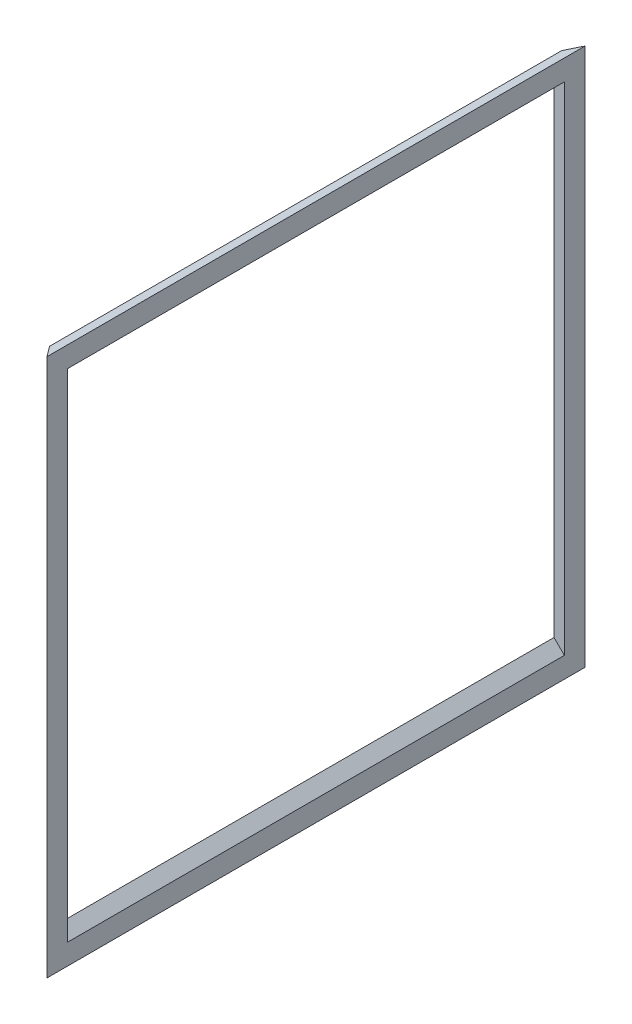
SolidWorks part; units mm, degrees
ref_plane "Front Plane" through (0, 0, 0) normal (1, 0, 0) x (0, 1, 0)
ref_plane "Top Plane" through (0, 0, 0) normal (0, 0, 1) x (0, 1, 0)
ref_plane "Right Plane" through (0, 0, 0) normal (0, 1, 0) x (-1, 0, 0)
sketch "Sketch1" plane through (0, 0, 0) normal (1, 0, 0) x (0, 1, 0)
  line L0 (-75.3872, 76.2) -> (81.7372, 76.2)
  line L1 (81.7372, 76.2) -> (81.7372, 78.5622)
  line L2 (81.7372, 78.5622) -> (-75.3872, 78.5622)
  line L3 (-75.3872, 78.5622) -> (-75.3872, 76.2)
ref_plane "Plane1" through (3.175, 0, 0) normal (1, 0, 0) x (0, 1, 0)
sketch "Sketch2" plane through (3.175, 0, 0) normal (1, 0, 0) x (0, 1, 0)
  line L0 (-82.55, 76.2) -> (82.55, 76.2)
  line L1 (82.55, 76.2) -> (82.55, 82.55)
  line L2 (82.55, 82.55) -> (-82.55, 82.55)
  line L3 (-82.55, 82.55) -> (-82.55, 76.2)
loft "Gap_bridge_0" add profiles "Sketch1", "Sketch2"
sketch "Sketch3" plane through (0, 0, 0) normal (1, 0, 0) x (0, 1, 0)
  line L0 (-75.3872, -78.5622) -> (81.7372, -78.5622)
  line L1 (81.7372, -78.5622) -> (81.7372, -76.2)
  line L2 (81.7372, -76.2) -> (-75.3872, -76.2)
  line L3 (-75.3872, -76.2) -> (-75.3872, -78.5622)
ref_plane "Plane2" through (3.175, 0, 0) normal (1, 0, 0) x (0, 1, 0)
sketch "Sketch4" plane through (3.175, 0, 0) normal (1, 0, 0) x (0, 1, 0)
  line L0 (-82.55, -82.55) -> (82.55, -82.55)
  line L1 (82.55, -82.55) -> (82.55, -76.2)
  line L2 (82.55, -76.2) -> (-82.55, -76.2)
  line L3 (-82.55, -76.2) -> (-82.55, -82.55)
loft "Gap_bridge_1" add profiles "Sketch3", "Sketch4"
sketch "Sketch5" plane through (0, 0, 0) normal (1, 0, 0) x (0, 1, 0)
  line L0 (79.375, -76.2) -> (81.7372, -76.2)
  line L1 (81.7372, -76.2) -> (81.7372, 76.2)
  line L2 (81.7372, 76.2) -> (79.375, 76.2)
  line L3 (79.375, 76.2) -> (79.375, -76.2)
ref_plane "Plane3" through (3.175, 0, 0) normal (1, 0, 0) x (0, 1, 0)
sketch "Sketch6" plane through (3.175, 0, 0) normal (1, 0, 0) x (0, 1, 0)
  line L0 (76.2, -76.2) -> (82.55, -76.2)
  line L1 (82.55, -76.2) -> (82.55, 76.2)
  line L2 (82.55, 76.2) -> (76.2, 76.2)
  line L3 (76.2, 76.2) -> (76.2, -76.2)
loft "Gap_bridge_2" add profiles "Sketch5", "Sketch6"
sketch "Sketch7" plane through (0, 0, 0) normal (1, 0, 0) x (0, 1, 0)
  line L0 (-75.3872, -76.2) -> (-73.025, -76.2)
  line L1 (-73.025, -76.2) -> (-73.025, 76.2)
  line L2 (-73.025, 76.2) -> (-75.3872, 76.2)
  line L3 (-75.3872, 76.2) -> (-75.3872, -76.2)
ref_plane "Plane4" through (3.175, 0, 0) normal (1, 0, 0) x (0, 1, 0)
sketch "Sketch8" plane through (3.175, 0, 0) normal (1, 0, 0) x (0, 1, 0)
  line L0 (-82.55, -76.2) -> (-76.2, -76.2)
  line L1 (-76.2, -76.2) -> (-76.2, 76.2)
  line L2 (-76.2, 76.2) -> (-82.55, 76.2)
  line L3 (-82.55, 76.2) -> (-82.55, -76.2)
loft "Gap_bridge_3" add profiles "Sketch7", "Sketch8"
